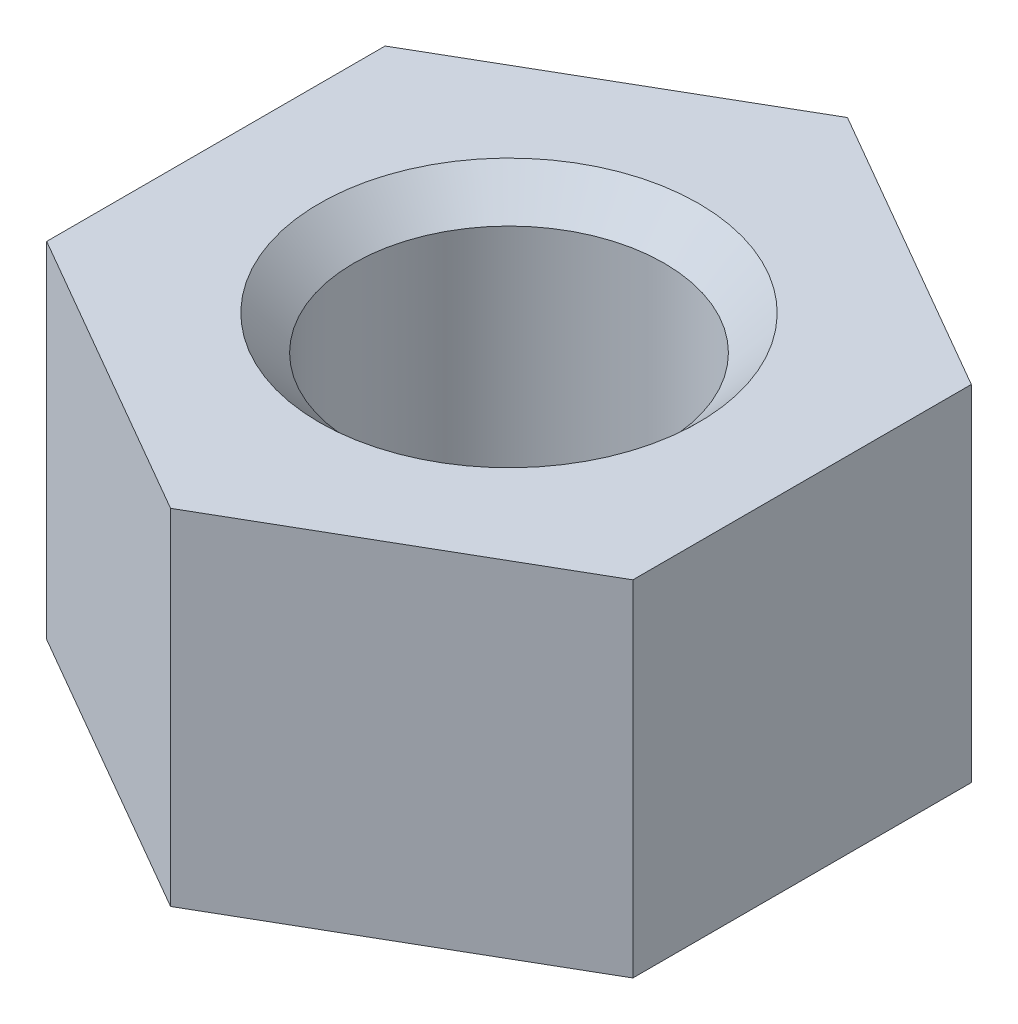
SolidWorks part; units mm, degrees
ref_plane "Front Plane" through (0, 0, 0) normal (0, 0, 1) x (1, 0, 0)
ref_plane "Top Plane" through (0, 0, 0) normal (0, 1, 0) x (1, 0, 0)
ref_plane "Right Plane" through (0, 0, 0) normal (1, 0, 0) x (0, 0, -1)
sketch "Sketch1" plane through (0, 0, 0) normal (0, 1, 0) x (1, 0, 0)
  line L1 (0, 9.815) -> (-8.5, 4.9075)
  line L2 (-8.5, 4.9075) -> (-8.5, -4.9075)
  line L3 (-8.5, -4.9075) -> (0, -9.815)
  line L4 (0, -9.815) -> (8.5, -4.9075)
  line L5 (8.5, -4.9075) -> (8.5, 4.9075)
  line L6 (8.5, 4.9075) -> (0, 9.815)
  circle A0 centre (0, 0) radius 8.5 construction
  circle A1 centre (0, 0) radius 4.5
  dimension "D1" = 17
  dimension "D2" = 9
extrude "Boss-Extrude1" add sketch "Sketch1" along normal blind 10
chamfer "Chamfer1" distance 1 angle 45 2 edges at (0, 0, 4.5) (0, 10, 4.5)
